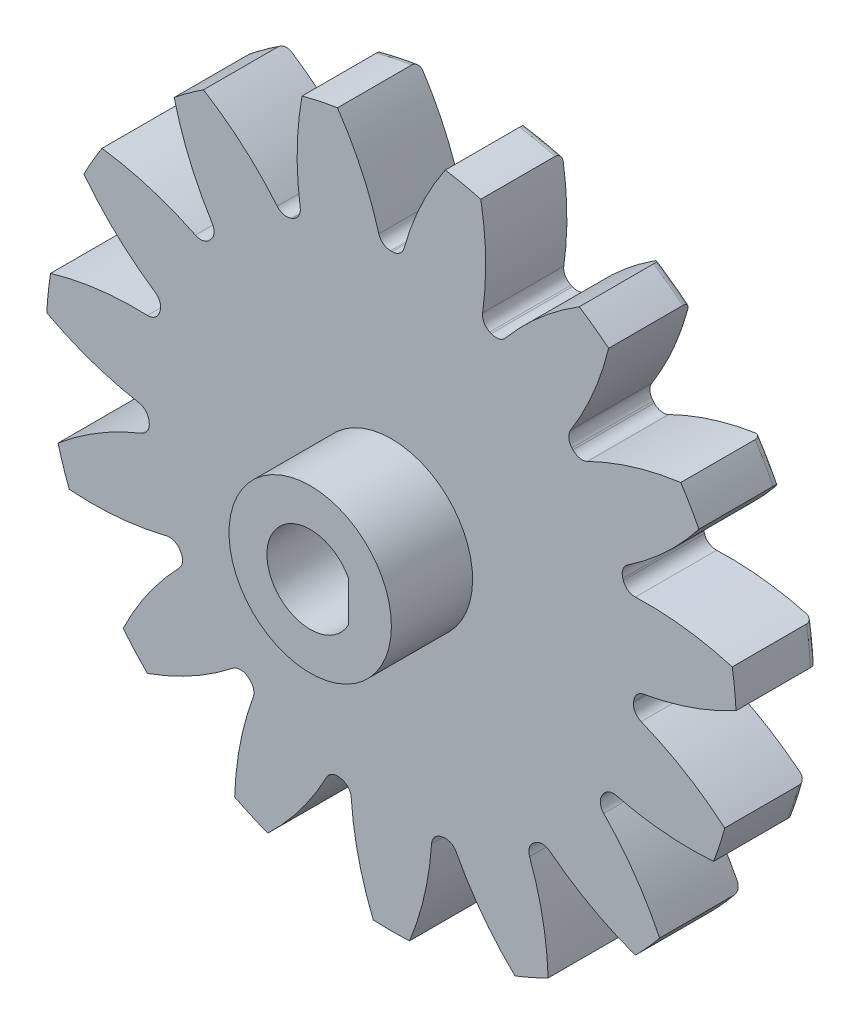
SolidWorks part; units mm, degrees
ref_plane "Front Plane" through (0, 0, 0) normal (0, 0, 1) x (1, 0, 0)
ref_plane "Top Plane" through (0, 0, 0) normal (0, 1, 0) x (1, 0, 0)
ref_plane "Right Plane" through (0, 0, 0) normal (1, 0, 0) x (0, 0, -1)
sketch "Sketch1" plane through (0, 0, 0) normal (0, 0, 1) x (1, 0, 0)
  line L0 (-190.5, 0) -> (190.5, 0) construction
  circle A0 centre (0, 0) radius 12.75 construction
  circle A1 centre (0, 0) radius 11.25 construction
  circle A2 centre (0, 0) radius 9 construction
  circle A3 centre (0, 0) radius 9 construction
  circle A4 centre (0, 0) radius 4 construction
sketch "Sketch2" plane through (0, 0, 0) normal (1, 0, 0) x (0, 0, -1)
  line L0 (0, 0) -> (-15, 0) construction
  line L1 (-15, 0) -> (-25, 0) construction
  dimension "Overall Width" = 25
  dimension "Face Width" = 15
sketch "Sketch4" plane through (0, 0, 0) normal (1, 0, 0) x (0, 0, -1)
  line L0 (-25, 4) -> (-25, 9)
  line L1 (-25, 9) -> (-15, 9)
  line L2 (-15, 9) -> (-15, 12.75)
  line L3 (-15, 12.75) -> (0, 12.75)
  line L4 (0, 12.75) -> (0, 4)
  line L5 (-15, 9) -> (-15, 0) construction
  line L6 (0, 12.75) -> (0, -12.75) construction
  line L7 (-15, 9) -> (0, 9) construction
  line L12 (-25, 4) -> (0, 4)
revolve "Revolve1" add sketch "Sketch4" angle 360 about L1
fillet "Fillet2" radius 0.255 4 edges at (0, 9, 25) (0, 9, 15) (0, 12.75, 15) (0, 12.75, 0)
sketch "Sketch7" plane through (0, 0, 15) normal (0, 0, 1) x (1, 0, 0)
  line L0 (0, 0) -> (0, 12.75) construction
  line L1 (1.1759, 11.1884) -> (1.8703, 12.6121) construction
  line L3 (2.6509, 12.4714) -> (2.339, 11.0042) construction
  line L4 (2.339, 11.0042) -> (1.8712, 8.8033) construction
  line L5 (0, 0) -> (1.8712, 8.8033) construction
  line L6 (1.1759, 11.1884) -> (0, 0) construction
  line L7 (1.1759, 11.1884) -> (1.3327, 12.6802) construction
  line L8 (1.1759, 11.1884) -> (0, 0) construction
  circle A0 centre (0, 0) radius 12.75 construction
  arc A1 (-0.03, 8.9999) -> (0.03, 8.9999) centre (0, 0) cw
  circle A2 centre (0, 0) radius 9 construction
  arc A3 (-1.1759, 11.1884) -> (1.1759, 11.1884) centre (0, 0) cw construction
  circle A4 centre (0, 0) radius 11.25 construction
  arc A5 (3.3026, 12.3148) -> (1.9918, 12.5935) centre (0, 0) ccw construction
  arc A6 (1.1759, 11.1884) -> (3.4764, 10.6994) centre (0, 0) cw construction
  arc A7 (-1.9918, 12.5935) -> (1.9918, 12.5935) centre (0, 0) cw
  arc A8 (0.4645, 9.3272) -> (1.9918, 12.5935) centre (11.2874, 6.2567) cw
  arc A9 (-0.4645, 9.3272) -> (-1.9918, 12.5935) centre (-11.2874, 6.2567) ccw
  arc A10 (-0.03, 8.9999) -> (-0.4645, 9.3272) centre (-0.0315, 9.45) cw
  arc A11 (0.03, 8.9999) -> (0.4645, 9.3272) centre (0.0315, 9.45) ccw
  point P26 (-0.375, 8.9922)
  point P29 (0.375, 8.9922)
extrude "Cut-Extrude2" cut sketch "Sketch7" against normal through all
pattern_circular "CirPattern1" count 15 over 360 about axis through (0, 0, 0) along (0, 0, 1) of "Cut-Extrude2"
sketch "Sketch8" plane through (0, 0, 0) normal (0, 0, -1) x (-1, 0, 0)
  circle A0 centre (0, 0) radius 15.5046
extrude "Cut-Extrude3" cut sketch "Sketch8" against normal through all from offset 3
sketch "Sketch9" plane through (0, 0, 3) normal (0, 0, 1) x (1, 0, 0)
  circle A0 centre (0, 0) radius 4.4969
extrude "Boss-Extrude1" add sketch "Sketch9" against normal up to surface (3 mm away)
sketch "Sketch10" plane through (0, 0, 3) normal (0, 0, 1) x (1, 0, 0)
  circle A0 centre (0, 0) radius 3
  dimension "D1" = 6
extrude "Boss-Extrude2" add sketch "Sketch10" along normal blind 3
sketch "Sketch11" plane through (0, 0, 6) normal (0, 0, 1) x (1, 0, 0)
  line L0 (1.4133, 0.75) -> (1.4133, -0.75)
  circle A0 centre (0, 0) radius 1.6
  dimension "D1" = 3.2
  dimension "D2" = 1.5
extrude "Cut-Extrude4" cut sketch "Sketch11" against normal through all contours L0 A0
equation "\"D1@Sketch1\"=2.5*(\"Pitch Dia.@Sketch1\"/\"Number of Teeth@Sketch1\")"
equation "\"D1@CirPattern1\"=\"Number of Teeth@Sketch1\""
equation "\"D1@Fillet2\"=\"OD@Sketch1\"*.01"
equation "\"D1@Sketch7\"=3.14159*(\"Pitch Dia.@Sketch1\"/\"Number of Teeth@Sketch1\")"
equation "\"D2@Sketch7\"=\"D1@Sketch7\"/2"
equation "\"D4@Sketch7\"=\"D1@Sketch7\"*.0955"
equation "\"D5@Sketch7\"=\"Pitch Dia.@Sketch1\"/2"
